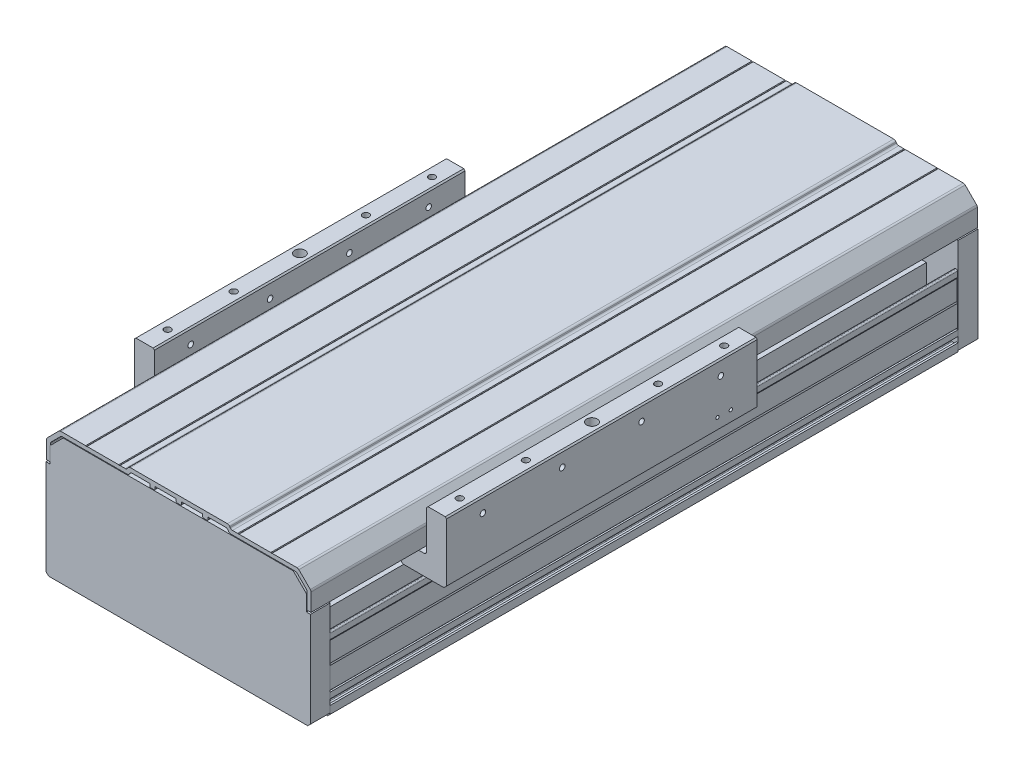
SolidWorks part; units mm, degrees
ref_plane "정면" through (0, 0, 0) normal (0, 0, 1) x (1, 0, 0)
ref_plane "윗면" through (0, 0, 0) normal (0, 1, 0) x (1, 0, 0)
ref_plane "우측면" through (0, 0, 0) normal (1, 0, 0) x (0, 0, -1)
sketch "스케치1" plane through (0, 0, 0) normal (0, 0, 1) x (1, 0, 0)
  line L0 (-99, 33.5) -> (-99, 48.5)
  line L1 (-97, 16.5) -> (-97, 53.5)
  line L2 (-99.5, 16.5) -> (-99.5, 32.5)
  line L3 (-97.5, 16) -> (-99, 16)
  line L4 (-99, 33.5) -> (-99.5, 32.5)
  line L5 (-98.5, 54.5) -> (-98, 54.5)
  line L6 (-99.5, 49.5) -> (-99.5, 53.5)
  line L7 (-99, 48.5) -> (-99.5, 49.5)
  line L8 (99, 33.5) -> (99, 48.5)
  line L9 (97, 16.5) -> (97, 53.5)
  line L10 (99.5, 16.5) -> (99.5, 32.5)
  line L11 (97.5, 16) -> (99, 16)
  line L12 (99, 33.5) -> (99.5, 32.5)
  line L13 (98.5, 54.5) -> (98, 54.5)
  line L14 (99.5, 49.5) -> (99.5, 53.5)
  line L15 (99, 48.5) -> (99.5, 49.5)
  line L16 (-78, 44.5) -> (-43.5, 44.5)
  line L17 (-36, -1) -> (-98, -1)
  line L18 (-66.55, 32.5) -> (-54.5, 32.5)
  line L19 (-100, 1) -> (-98, -1)
  line L20 (-78, 44.5) -> (-78, 37.5)
  line L21 (-69.5, 14.5) -> (-69.5, 30.0927)
  line L22 (-77.7, 37) -> (-78, 36.5)
  line L23 (-78, 37.5) -> (-77.7, 37)
  line L24 (-78, 26.5) -> (-77.1807, 25.0809)
  line L25 (-78, 36.5) -> (-78, 26.5)
  line L26 (-97, 21) -> (-97, 15.5)
  line L27 (-97, 25.5) -> (-97, 22)
  line L28 (-97, 15.5) -> (-100, 15.5)
  line L29 (36, -1) -> (98, -1)
  line L30 (35, 0) -> (-35, 0)
  line L31 (-35, 0) -> (-36, -1)
  line L32 (36, -1) -> (35, 0)
  line L33 (100, 1) -> (98, -1)
  line L34 (-16.9019, 9.5) -> (-14.3038, 11)
  line L35 (-14.3038, 5) -> (-16.9019, 6.5)
  line L36 (-22.5, 16) -> (22.5, 16)
  line L37 (-23, 16.5) -> (-22.5, 16)
  line L38 (-16.9019, 9.5) -> (-18.0629, 9.5)
  line L39 (-16.9019, 6.5) -> (-18.0629, 6.5)
  line L40 (-52.5, 30.5) -> (-52.5, 16.25)
  line L41 (-52, 15.75) -> (-51.4079, 15.75)
  line L42 (-51.6685, 12.5) -> (-67.5, 12.5)
  line L43 (-38.5, 16.5) -> (-23, 16.5)
  line L44 (22.5, 16) -> (23, 16.5)
  line L45 (23, 16.5) -> (38.5, 16.5)
  line L46 (16.9019, 9.5) -> (14.3038, 11)
  line L47 (14.3038, 5) -> (16.9019, 6.5)
  line L48 (16.9019, 9.5) -> (18.0629, 9.5)
  line L49 (16.9019, 6.5) -> (18.0629, 6.5)
  line L50 (-4, 9) -> (4, 9)
  line L51 (-7.3333, 11) -> (-4, 9)
  line L52 (7.3333, 11) -> (4, 9)
  line L53 (-14.3038, 11) -> (-7.3333, 11)
  line L54 (-14.3038, 5) -> (14.3038, 5)
  line L55 (7.3333, 11) -> (14.3038, 11)
  line L56 (43.5, 22.5) -> (43.5, 44.5)
  line L57 (97, 21) -> (97, 15.5)
  line L58 (97, 15.5) -> (100, 15.5)
  line L59 (97, 25.5) -> (97, 22)
  line L60 (95, 25.5) -> (97, 25.5)
  line L61 (95, 24) -> (95, 25.5)
  line L62 (71, 47.5) -> (71, 44.5)
  line L63 (71, 47.5) -> (76, 47.5)
  line L64 (71, 44.5) -> (43.5, 44.5)
  line L65 (100, 1) -> (100, 6.85)
  line L66 (98.5, 11.15) -> (100, 11.15)
  line L67 (98.5, 12.65) -> (98.5, 11.15)
  line L68 (95.5, 12.65) -> (98.5, 12.65)
  line L69 (95, 5.85) -> (95, 12.15)
  line L70 (98.5, 5.35) -> (95.5, 5.35)
  line L71 (98.5, 6.85) -> (98.5, 5.35)
  line L72 (100, 6.85) -> (98.5, 6.85)
  line L73 (100, 11.15) -> (100, 15.5)
  line L74 (-100, 1) -> (-100, 6.85)
  line L75 (-98.5, 11.15) -> (-100, 11.15)
  line L76 (-98.5, 12.65) -> (-98.5, 11.15)
  line L77 (-95.5, 12.65) -> (-98.5, 12.65)
  line L78 (-95, 5.85) -> (-95, 12.15)
  line L79 (-98.5, 5.35) -> (-95.5, 5.35)
  line L80 (-98.5, 6.85) -> (-98.5, 5.35)
  line L81 (-100, 6.85) -> (-98.5, 6.85)
  line L82 (-100, 11.15) -> (-100, 15.5)
  line L83 (38.5, 17.5) -> (38.5, 16.5)
  line L84 (-43.5, 22.5) -> (-43.5, 44.5)
  line L85 (-38.5, 17.5) -> (-38.5, 16.5)
  line L86 (80.8, 21) -> (79.5, 21)
  line L87 (79.5, 18) -> (93.5, 18)
  line L88 (79.5, 21) -> (79.5, 18)
  line L89 (92, 21.2) -> (92, 22.8)
  line L90 (92.2, 21) -> (92, 21.2)
  line L91 (93.5, 21) -> (92.2, 21)
  line L92 (92.2, 23) -> (94, 23)
  line L93 (92, 22.8) -> (92.2, 23)
  line L94 (93.5, 18) -> (93.5, 21)
  line L95 (81, 22.8) -> (81, 21.2)
  line L96 (81, 21.2) -> (80.8, 21)
  line L97 (80.8, 23) -> (81, 22.8)
  line L98 (78.4, 23) -> (80.8, 23)
  line L99 (-95, 25.5) -> (-97, 25.5)
  line L100 (-95, 24) -> (-95, 25.5)
  line L101 (-80.8, 21) -> (-79.5, 21)
  line L102 (-79.5, 18) -> (-93.5, 18)
  line L103 (-79.5, 21) -> (-79.5, 18)
  line L104 (-92, 21.2) -> (-92, 22.8)
  line L105 (-92.2, 21) -> (-92, 21.2)
  line L106 (-93.5, 21) -> (-92.2, 21)
  line L107 (-92.2, 23) -> (-94, 23)
  line L108 (-92, 22.8) -> (-92.2, 23)
  line L109 (-93.5, 18) -> (-93.5, 21)
  line L110 (-81, 22.8) -> (-81, 21.2)
  line L111 (-81, 21.2) -> (-80.8, 21)
  line L112 (-80.8, 23) -> (-81, 22.8)
  line L113 (-78.4, 23) -> (-80.8, 23)
  line L114 (76, 47.5) -> (76, 31.4999)
  line L115 (76, 31.4999) -> (76.3, 31.4999)
  line L116 (76.3, 31.4999) -> (76.3, 24.581)
  line L117 (-97, 22) -> (-96.7, 21.5)
  line L118 (-96.7, 21.5) -> (-97, 21)
  line L119 (97, 22) -> (96.7, 21.5)
  line L120 (96.7, 21.5) -> (97, 21)
  line L121 (66.55, 32.5) -> (54.5, 32.5)
  line L122 (69.5, 14.5) -> (69.5, 30.0927)
  line L123 (52.5, 30.5) -> (52.5, 16.25)
  line L124 (52, 15.75) -> (51.4079, 15.75)
  line L125 (51.6685, 12.5) -> (67.5, 12.5)
  arc A0 (-99.5, 16.5) -> (-99, 16) centre (-99, 16.5) ccw
  arc A1 (-97.5, 16) -> (-97, 16.5) centre (-97.5, 16.5) ccw
  arc A2 (-98.5, 54.5) -> (-99.5, 53.5) centre (-98.5, 53.5) ccw
  arc A3 (-97, 53.5) -> (-98, 54.5) centre (-98, 53.5) ccw
  arc A4 (99, 16) -> (99.5, 16.5) centre (99, 16.5) ccw
  arc A5 (97, 16.5) -> (97.5, 16) centre (97.5, 16.5) ccw
  arc A6 (99.5, 53.5) -> (98.5, 54.5) centre (98.5, 53.5) ccw
  arc A7 (98, 54.5) -> (97, 53.5) centre (98, 53.5) ccw
  arc A8 (-69.5, 14.5) -> (-67.5, 12.5) centre (-67.5, 14.5) ccw
  arc A9 (-77.4769, 22.3846) -> (-76.1936, 24.5882) centre (-76, 23) ccw
  arc A10 (-77.4769, 22.3846) -> (-78.4, 23) centre (-78.4, 22) ccw
  arc A11 (-67.05, 33) -> (-66.55, 32.5) centre (-66.55, 33) ccw
  arc A12 (-77.1807, 25.0809) -> (-76.1936, 24.5882) centre (-76.3147, 25.5809) ccw
  arc A13 (-69.5, 30.0927) -> (-69.9153, 30.5854) centre (-70, 30.0927) ccw
  arc A14 (-18.0629, 9.5) -> (-18.0629, 6.5) centre (-20, 8) ccw
  arc A15 (-52.5, 16.25) -> (-52, 15.75) centre (-52, 16.25) ccw
  arc A16 (-51.4079, 15.75) -> (-51.0845, 15.8686) centre (-51.4079, 16.25) ccw
  arc A17 (-51.301, 12.339) -> (-51.0845, 15.8686) centre (-49.5, 14) ccw
  arc A18 (-51.301, 12.339) -> (-51.6685, 12.5) centre (-51.6685, 12) ccw
  arc A19 (-52.5, 30.5) -> (-54.5, 32.5) centre (-54.5, 30.5) ccw
  arc A20 (18.0629, 6.5) -> (18.0629, 9.5) centre (20, 8) ccw
  arc A21 (38.5, 17.5) -> (43.5, 22.5) centre (38.5, 22.5) ccw
  arc A22 (78.4, 23) -> (77.4769, 22.3846) centre (78.4, 22) ccw
  arc A23 (94, 23) -> (95, 24) centre (94, 24) ccw
  arc A24 (95.5, 12.65) -> (95, 12.15) centre (95.5, 12.15) ccw
  arc A25 (95, 5.85) -> (95.5, 5.35) centre (95.5, 5.85) ccw
  arc A26 (-95, 12.15) -> (-95.5, 12.65) centre (-95.5, 12.15) ccw
  arc A27 (-95.5, 5.35) -> (-95, 5.85) centre (-95.5, 5.85) ccw
  arc A28 (-43.5, 22.5) -> (-38.5, 17.5) centre (-38.5, 22.5) ccw
  arc A29 (-67.05, 33) -> (-69.9153, 30.5854) centre (-69.5, 33) ccw
  arc A30 (-95, 24) -> (-94, 23) centre (-94, 24) ccw
  arc A31 (76.1936, 24.5882) -> (77.4769, 22.3846) centre (76, 23) ccw
  arc A32 (76.1936, 24.5882) -> (76.3, 24.581) centre (76.3147, 25.5809) ccw
  arc A33 (67.5, 12.5) -> (69.5, 14.5) centre (67.5, 14.5) ccw
  arc A34 (66.55, 32.5) -> (67.05, 33) centre (66.55, 33) ccw
  arc A35 (69.9153, 30.5854) -> (69.5, 30.0927) centre (70, 30.0927) ccw
  arc A36 (52, 15.75) -> (52.5, 16.25) centre (52, 16.25) ccw
  arc A37 (51.0845, 15.8686) -> (51.4079, 15.75) centre (51.4079, 16.25) ccw
  arc A38 (51.0845, 15.8686) -> (51.301, 12.339) centre (49.5, 14) ccw
  arc A39 (51.6685, 12.5) -> (51.301, 12.339) centre (51.6685, 12) ccw
  arc A40 (54.5, 32.5) -> (52.5, 30.5) centre (54.5, 30.5) ccw
  arc A41 (69.9153, 30.5854) -> (67.05, 33) centre (69.5, 33) ccw
extrude "보스-돌출1" add sketch "스케치1" along normal mid plane 475 contours A31 A32 L116 L115 L114 L63 L62 L64 L56 A21 L83 L45 L44 L36 L37 L43 L85 A28 L84 L16 L20 L23 L22 L25 L24 A12 A9 A10 L113 L112 L110 L111 L101 L103 L102 L109 L106 L105 L104 L108 L107 A30 L100 L99 L1 L117 L118 L26 L28 L82 | L9 A7 L13 A6 L14 L15 L8 L12 L10 A4 L11 A5
sketch "스케치2" plane through (0, 0, 237.5) normal (0, 0, 1) x (1, 0, 0)
  line L0 (97, 86) -> (87, 96)
  line L1 (-98, 0) -> (98, 0)
  line L2 (-87, 96) -> (87, 96)
  line L3 (-100, 74) -> (-100, 2)
  line L4 (-100, 2) -> (-98, 0)
  line L5 (-97, 86) -> (-87, 96)
  line L6 (-97, 86) -> (-97, 74)
  line L7 (-100, 74) -> (-97, 74)
  line L8 (100, 74) -> (100, 2)
  line L9 (100, 2) -> (98, 0)
  line L10 (97, 86) -> (97, 74)
  line L11 (97, 74) -> (100, 74)
extrude "보스-돌출2" add sketch "스케치2" along normal blind 15 separate body
sketch "스케치3" plane through (0, 0, -237.5) normal (0, 0, -1) x (-1, 0, 0)
  line L0 (97, 86) -> (87, 96)
  line L1 (-98, 0) -> (98, 0)
  line L2 (-87, 96) -> (87, 96)
  line L3 (-100, 74) -> (-100, 2)
  line L4 (-100, 2) -> (-98, 0)
  line L5 (-97, 86) -> (-87, 96)
  line L6 (-97, 86) -> (-97, 74)
  line L7 (-100, 74) -> (-97, 74)
  line L8 (100, 74) -> (100, 2)
  line L9 (100, 2) -> (98, 0)
  line L10 (97, 86) -> (97, 74)
  line L11 (97, 74) -> (100, 74)
extrude "보스-돌출3" add sketch "스케치3" along normal blind 15 separate body
ref_plane "평면1" through (0, 0, 167.5) normal (0, 0, 1) x (1, 0, 0)
sketch "스케치4" plane through (0, 0, 167.5) normal (0, 0, 1) x (1, 0, 0)
  line L0 (0, 0) -> (0, 72.5) construction
  line L1 (35, 0) -> (-35, 0) construction
  line L2 (104, 104) -> (103, 103)
  line L3 (103, 103) -> (103, 74)
  line L4 (101, 72) -> (96, 72)
  line L5 (94, 74) -> (94, 77.5)
  line L6 (84, 87.5) -> (58.5, 87.5)
  line L7 (58.5, 87.5) -> (56.5, 89.5)
  line L8 (56.5, 89.5) -> (-56.5, 89.5)
  line L9 (-56.5, 89.5) -> (-58.5, 87.5)
  line L10 (-58.5, 87.5) -> (-84, 87.5)
  line L11 (-94, 77.5) -> (-94, 74)
  line L12 (-96, 72) -> (-101, 72)
  line L13 (-103, 74) -> (-103, 103)
  line L14 (-103, 103) -> (-104, 104)
  line L15 (83, 72.5) -> (-83, 72.5)
  line L16 (-118, 59) -> (-118, 103)
  line L17 (-118, 59) -> (-118, 103)
  line L18 (-116, 57) -> (-85, 57)
  line L19 (-118, 59) -> (-116, 57)
  line L20 (-85, 57) -> (-83, 59)
  line L21 (-83, 59) -> (-83, 72.5)
  line L22 (-117, 104) -> (-104, 104)
  line L23 (-117, 104) -> (-118, 103)
  line L26 (83, 72.5) -> (83, 59)
  line L27 (84, 87.5) -> (58.5, 87.5)
  line L28 (118, 59) -> (118, 103)
  line L29 (85, 57) -> (116, 57)
  line L30 (116, 57) -> (118, 59)
  line L31 (117, 104) -> (104, 104)
  line L32 (118, 103) -> (117, 104)
  line L33 (81.75, 87.5) -> (84, 87.5)
  line L34 (83, 59) -> (85, 57)
  arc A0 (101, 72) -> (103, 74) centre (101, 74) ccw
  arc A1 (94, 74) -> (96, 72) centre (96, 74) ccw
  arc A2 (94, 77.5) -> (84, 87.5) centre (84, 77.5) ccw
  arc A3 (-84, 87.5) -> (-94, 77.5) centre (-84, 77.5) ccw
  arc A4 (-96, 72) -> (-94, 74) centre (-96, 74) ccw
  arc A5 (-103, 74) -> (-101, 72) centre (-101, 74) ccw
  dimension "D1" = 72.5
extrude "보스-돌출4" add sketch "스케치4" against normal blind 235 separate body contours A5 L13 L14 L22 L23 L16 L19 L18 L20 L21 L15 L26 L34 L29 L30 L28 L32 L31 L2 L3 A0 L4 A1 L5 A2 L6 L27 L7 L8 L9 L10 A3 L11 A4 L12
sketch "스케치5" plane through (0, 0, 0) normal (0, 0, 1) x (1, 0, 0)
  line L0 (0, 0) -> (0, 101.5) construction
  line L1 (-98, 0) -> (98, 0) construction
  line L2 (36.7494, 101.5) -> (-36.7494, 101.5)
  line L3 (-45.5, 99) -> (-69.5, 99)
  line L4 (-88.1265, 96) -> (-39.2151, 96)
  line L5 (-90.7833, 98.4142) -> (-99.4142, 89.7833)
  line L6 (-96.4142, 88.5407) -> (-89.5407, 95.4142)
  line L7 (-100, 75) -> (-97, 75)
  line L8 (-97, 75) -> (-97, 87.1265)
  line L9 (-100, 88.3691) -> (-100, 75)
  line L10 (-70.5, 99) -> (-89.3691, 99)
  line L11 (-70, 98.7) -> (-70.5, 99)
  line L12 (-69.5, 99) -> (-70, 98.7)
  line L13 (-37.518, 96.9417) -> (-37.1335, 97.5583)
  line L14 (-40.528, 99) -> (-44.5, 99)
  line L15 (-45, 98.7) -> (-45.5, 99)
  line L16 (-44.5, 99) -> (-45, 98.7)
  line L17 (-38.4465, 100.5583) -> (-38.831, 99.9417)
  line L18 (2.25, 98.5) -> (17.75, 98.5)
  line L19 (-18, 96.75) -> (-18, 98.25)
  line L20 (-22, 98.25) -> (-22, 96.75)
  line L21 (-21.25, 96) -> (-18.75, 96)
  line L22 (2, 96.75) -> (2, 98.25)
  line L23 (-1.25, 96) -> (1.25, 96)
  line L24 (-2, 98.25) -> (-2, 96.75)
  line L25 (-17.75, 98.5) -> (-2.25, 98.5)
  line L26 (-35.4364, 98.5) -> (-22.25, 98.5)
  line L27 (22, 96.75) -> (22, 98.25)
  line L28 (18.75, 96) -> (21.25, 96)
  line L29 (18, 98.25) -> (18, 96.75)
  line L30 (22.25, 98.5) -> (35.4364, 98.5)
  line L31 (89.3691, 99) -> (70.5, 99)
  line L32 (39.2151, 96) -> (88.1265, 96)
  line L33 (37.1335, 97.5583) -> (37.518, 96.9417)
  line L34 (69.5, 99) -> (45.5, 99)
  line L35 (38.831, 99.9417) -> (38.4465, 100.5583)
  line L36 (44.5, 99) -> (40.528, 99)
  line L37 (45, 98.7) -> (44.5, 99)
  line L38 (45.5, 99) -> (45, 98.7)
  line L39 (70, 98.7) -> (69.5, 99)
  line L40 (70.5, 99) -> (70, 98.7)
  line L41 (99.4142, 89.7833) -> (90.7833, 98.4142)
  line L42 (97, 75) -> (100, 75)
  line L43 (89.5407, 95.4142) -> (96.4142, 88.5407)
  line L44 (97, 87.1265) -> (97, 75)
  line L45 (100, 75) -> (100, 88.3691)
  arc A0 (-88.1265, 96) -> (-89.5407, 95.4142) centre (-88.1265, 94) ccw
  arc A1 (-96.4142, 88.5407) -> (-97, 87.1265) centre (-95, 87.1265) ccw
  arc A2 (-99.4142, 89.7833) -> (-100, 88.3691) centre (-98, 88.3691) ccw
  arc A3 (-89.3691, 99) -> (-90.7833, 98.4142) centre (-89.3691, 97) ccw
  arc A4 (-35.4364, 98.5) -> (-37.1335, 97.5583) centre (-35.4364, 96.5) ccw
  arc A5 (-39.2151, 96) -> (-37.518, 96.9417) centre (-39.2151, 98) ccw
  arc A6 (-36.7494, 101.5) -> (-38.4465, 100.5583) centre (-36.7494, 99.5) ccw
  arc A7 (-40.528, 99) -> (-38.831, 99.9417) centre (-40.528, 101) ccw
  arc A8 (2.25, 98.5) -> (2, 98.25) centre (2.25, 98.25) ccw
  arc A9 (-2, 98.25) -> (-2.25, 98.5) centre (-2.25, 98.25) ccw
  arc A10 (-17.75, 98.5) -> (-18, 98.25) centre (-17.75, 98.25) ccw
  arc A11 (-22, 98.25) -> (-22.25, 98.5) centre (-22.25, 98.25) ccw
  arc A12 (-18.75, 96) -> (-18, 96.75) centre (-18.75, 96.75) ccw
  arc A13 (-22, 96.75) -> (-21.25, 96) centre (-21.25, 96.75) ccw
  arc A14 (1.25, 96) -> (2, 96.75) centre (1.25, 96.75) ccw
  arc A15 (-2, 96.75) -> (-1.25, 96) centre (-1.25, 96.75) ccw
  arc A16 (22.25, 98.5) -> (22, 98.25) centre (22.25, 98.25) ccw
  arc A17 (18, 98.25) -> (17.75, 98.5) centre (17.75, 98.25) ccw
  arc A18 (21.25, 96) -> (22, 96.75) centre (21.25, 96.75) ccw
  arc A19 (18, 96.75) -> (18.75, 96) centre (18.75, 96.75) ccw
  arc A20 (37.1335, 97.5583) -> (35.4364, 98.5) centre (35.4364, 96.5) ccw
  arc A21 (37.518, 96.9417) -> (39.2151, 96) centre (39.2151, 98) ccw
  arc A22 (38.4465, 100.5583) -> (36.7494, 101.5) centre (36.7494, 99.5) ccw
  arc A23 (38.831, 99.9417) -> (40.528, 99) centre (40.528, 101) ccw
  arc A24 (89.5407, 95.4142) -> (88.1265, 96) centre (88.1265, 94) ccw
  arc A25 (97, 87.1265) -> (96.4142, 88.5407) centre (95, 87.1265) ccw
  arc A26 (100, 88.3691) -> (99.4142, 89.7833) centre (98, 88.3691) ccw
  arc A27 (90.7833, 98.4142) -> (89.3691, 99) centre (89.3691, 97) ccw
  dimension "D1" = 101.5
extrude "보스-돌출5" add sketch "스케치5" along normal mid plane 504 separate body
hole_wizard "M8 육각 머리 볼트용 카운터보어1" positions "스케치8" profile "스케치7" counterbore size "M8" standard "ISO"
sketch "스케치8" plane through (0, 18, 0) normal (0, 1, 0) x (-1, 0, 0)
  line L0 (-35, 237.5) -> (35, 237.5) construction
  line L1 (-36, 237.5) -> (-98, 237.5) construction
  point P0 (86.5, 120)
  point P1 (-86.5, 120)
  point P8 (0, 237.5)
  dimension "D1" = 173
  dimension "D2" = 86.5
  dimension "D3" = 117.5
sketch "스케치7" plane through (-86.5, 18, 120) normal (1, 0, 0) x (0, 0, 1)
  line L0 (0, 0) -> (0, 19)
  line L1 (0, 19) -> (4.5, 19)
  line L3 (4.5, 19) -> (4.5, 9)
  line L4 (4.5, 9) -> (7, 9)
  line L5 (7, 9) -> (7, 0)
  line L7 (7, 0) -> (0, 0)
  line L11 (0, -6.35) -> (0, 107.95) construction
  dimension "관통 구멍 지름" = 9
  dimension "관통 구멍 깊이" = 19
  dimension "카운터보어 지름" = 14
  dimension "카운터보어 깊이" = 9
pattern_linear "선형 패턴1" count 2 spacing 240 along (0, 0, -1) of "M8 육각 머리 볼트용 카운터보어1"
hole_wizard "M6 나사 구멍1" positions "스케치10" profile "스케치9" tap size "M6" standard "ISO"
sketch "스케치10" plane through (0, 104, 0) normal (0, 1, 0) x (-1, 0, 0)
  line L0 (-117, 167.5) -> (-104, 167.5) construction
  line L1 (-118, -67.5) -> (-118, 167.5) construction
  point P0 (-110.5, 150)
  point P1 (-110.5, 100)
  point P3 (-110.5, 0)
  point P5 (-110.5, -50)
  dimension "D1" = 17.5
  dimension "D2" = 50
  dimension "D3" = 100
  dimension "D4" = 50
  dimension "D5" = 7.5
sketch "스케치9" plane through (110.5, 104, 150) normal (1, 0, 0) x (0, 0, 1)
  line L0 (0, 0) -> (0, 24.5022)
  line L1 (0, 24.5022) -> (2.5, 23)
  line L2 (2.5, 23) -> (2.5, 0)
  line L5 (2.5, 0) -> (0, 0)
  line L10 (0, 24.5022) -> (-2.5, 23) construction
  line L11 (0, -6.35) -> (0, 107.95) construction
  dimension "탭 드릴 지름" = 5
  dimension "탭 드릴 깊이" = 23
  dimension "드릴 각도" = 118
hole_wizard "M5 나사 구멍1" positions "스케치12" profile "스케치11" tap size "M5" standard "ISO"
sketch "스케치12" plane through (118, 0, 0) normal (1, 0, 0) x (0, 0, -1)
  line L0 (-167.5, 59) -> (-167.5, 103) construction
  line L2 (67.5, 104) -> (-167.5, 104) construction
  point P0 (-140, 93)
  point P1 (-80, 93)
  point P3 (-20, 93)
  point P5 (40, 93)
  dimension "D1" = 27.5
  dimension "D2" = 60
  dimension "D3" = 60
  dimension "D4" = 60
  dimension "D5" = 11
sketch "스케치11" plane through (118, 93, 140) normal (0, 1, 0) x (0, 0, -1)
  line L0 (0, 0) -> (0, 17.2618)
  line L1 (0, 17.2618) -> (2.1, 16)
  line L2 (2.1, 16) -> (2.1, 0)
  line L5 (2.1, 0) -> (0, 0)
  line L10 (0, 17.2618) -> (-2.1, 16) construction
  line L11 (0, -6.35) -> (0, 107.95) construction
  dimension "탭 드릴 지름" = 4.2
  dimension "탭 드릴 깊이" = 16
  dimension "드릴 각도" = 118
sketch "스케치13" plane through (0, 104, 0) normal (0, 1, 0) x (1, 0, 0)
  line L0 (117, 67.5) -> (104, 67.5) construction
  line L1 (118, 67.5) -> (118, -167.5) construction
  circle A0 centre (110.5, -50) radius 2.5
  dimension "D1" = 5
  dimension "D2" = 117.5
  dimension "D3" = 7.5
extrude "컷-돌출1" cut sketch "스케치13" against normal up to next (47 mm away)
sketch "스케치14" plane through (0, 104, 0) normal (0, 1, 0) x (1, 0, 0)
  circle A0 centre (110.5, -50) radius 4
  dimension "D1" = 8
extrude "컷-돌출2" cut sketch "스케치14" against normal blind 18
mirror "대칭 복사1" about plane through (0, 0, 0) normal (1, 0, 0) of "컷-돌출2", "컷-돌출1", "M5 나사 구멍1", "M6 나사 구멍1"
hole_wizard "M3 나사 구멍1" positions "스케치16" profile "스케치15" tap size "M3" standard "ISO"
sketch "스케치16" plane through (118, 0, 0) normal (1, 0, 0) x (0, 0, -1)
  line L0 (67.5, 59) -> (67.5, 103) construction
  line L1 (67.5, 57) -> (-167.5, 57) construction
  point P0 (47.5, 67)
  point P1 (37.5, 67)
  dimension "D1" = 20
  dimension "D2" = 10
  dimension "D3" = 10
sketch "스케치15" plane through (118, 67, -47.5) normal (0, 1, 0) x (0, 0, -1)
  line L0 (0, 0) -> (0, 13.2511)
  line L1 (0, 13.2511) -> (1.25, 12.5)
  line L2 (1.25, 12.5) -> (1.25, 0)
  line L5 (1.25, 0) -> (0, 0)
  line L10 (0, 13.2511) -> (-1.25, 12.5) construction
  line L11 (0, -6.35) -> (0, 107.95) construction
  dimension "탭 드릴 지름" = 2.5
  dimension "탭 드릴 깊이" = 12.5
  dimension "드릴 각도" = 118
mirror "대칭 복사2" about plane through (0, 0, 0) normal (1, 0, 0) of "M3 나사 구멍1"
